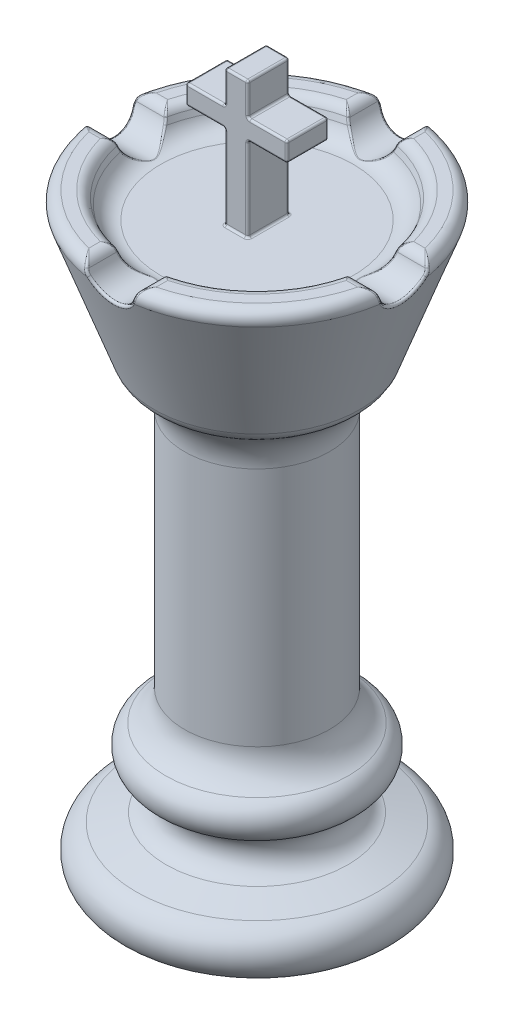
SolidWorks part; units mm, degrees
ref_plane "Front" through (0, 0, 0) normal (0, 0, 1) x (1, 0, 0)
ref_plane "Top" through (0, 0, 0) normal (0, 1, 0) x (1, 0, 0)
ref_plane "Right" through (0, 0, 0) normal (1, 0, 0) x (0, 0, -1)
sketch "Sketch1" plane through (0, 0, 0) normal (0, 0, 1) x (1, 0, 0)
  line L0 (0, 0) -> (0, 72.0534) construction
  line L1 (0, 0) -> (13.97, 0)
  line L2 (14.8003, 5.9807) -> (11.1344, 7.0186)
  line L3 (8.89, 20.2472) -> (8.89, 49.7112)
  line L4 (12.6183, 56.0518) -> (18.796, 73.025)
  line L5 (18.796, 73.025) -> (14.732, 73.025)
  line L6 (0, 69.85) -> (0, 0)
  line L7 (14.732, 73.025) -> (14.1847, 71.5213)
  line L8 (11.7979, 69.85) -> (0, 69.85)
  arc A0 (13.97, 0) -> (14.8003, 5.9807) centre (13.97, 3.048) ccw
  arc A1 (11.1344, 7.0186) -> (10.941, 11.8433) centre (11.8263, 9.4625) cw
  arc A2 (10.941, 11.8433) -> (11.2008, 16.4912) centre (10.0557, 14.224) ccw
  arc A3 (11.2008, 16.4912) -> (8.89, 20.2472) centre (13.0979, 20.2472) cw
  arc A4 (8.89, 49.7112) -> (11.6298, 54.8002) centre (14.986, 49.7112) cw
  arc A5 (11.7979, 69.85) -> (14.1847, 71.5213) centre (11.7979, 72.39) ccw
  arc A6 (12.6183, 56.0518) -> (11.6298, 54.8002) centre (10.2315, 56.9206) cw
  dimension "D2" = 3.048
  dimension "D4" = 2.54
  dimension "D5" = 2.54
  dimension "D7" = 8.89
  dimension "D8" = 4.064
  dimension "D9" = 3.175
  dimension "D11" = 6.096
  dimension "D12" = 14.224
  dimension "D13" = 29.464
  dimension "D14" = 13.97
  dimension "D15" = 11.8263
  dimension "D16" = 4.2079
  dimension "D3" = 3.81
  dimension "D6" = 69.85
  dimension "D10" = 110
  dimension "D17" = 18.796
revolve "Base-Revolve" add sketch "Sketch1" angle 360 about L0
sketch "Sketch2" plane through (0, 73.025, 0) normal (0, 1, 0) x (-1, 0, 0)
  line L0 (0, 0) -> (0, 21.3897) construction
  line L2 (0, 18.796) -> (-3.048, 18.796)
  line L3 (0, 18.796) -> (0, 12.446)
  line L4 (0, 12.446) -> (-3.048, 12.446)
  line L5 (-3.048, 18.796) -> (-3.048, 12.446)
  circle A1 centre (0, 0) radius 18.796 construction
  dimension "D1" = 3.048
  dimension "D2" = 6.35
revolve "Cut-Revolve1" cut sketch "Sketch2" angle 360 about L0
pattern_circular "CirPattern1" count 4 over 360 about axis through (0, 0, 0) along (0, 1, 0) of "Cut-Revolve1"
sketch "Sketch3" plane through (0, 0, 0) normal (0, 0, 1) x (1, 0, 0)
  line L0 (0, 69.85) -> (0, 86.5176)
  line L1 (0, 0) -> (0, 72.0534) construction
  line L2 (0, 86.5176) -> (1.4119, 86.5176)
  line L3 (1.4119, 86.5176) -> (1.4119, 82.5643)
  line L4 (1.4119, 82.5643) -> (6.2124, 82.5643)
  line L5 (6.2124, 82.5643) -> (6.2124, 80.164)
  line L6 (6.2124, 80.164) -> (1.4119, 80.164)
  line L7 (1.4119, 80.164) -> (1.4119, 69.85)
  line L8 (11.7979, 69.85) -> (-11.7979, 69.85) construction
  line L9 (1.4119, 69.85) -> (0, 69.85)
extrude "Boss-Extrude1" add sketch "Sketch3" along normal mid plane 5.08
mirror "Mirror1" about plane through (0, 69.85, 2.54) normal (1, 0, 0) of "Boss-Extrude1"
fillet "Fillet1" radius 1.27 24 edges at (-10.4171, 73.025, 10.4171) (-13.2908, 73.025, 13.2908) (3.048, 73.025, 16.4802) (-0.4065, 70.0042, 17.6919) (-3.048, 73.025, 16.4802) (-2.8751, 72.0129, 14.073) (10.4171, 73.025, 10.4171) (13.2908, 73.025, 13.2908) (16.4802, 73.025, -3.048) (17.6919, 70.0042, 0.4065) (16.4802, 73.025, 3.048) (14.073, 72.0129, 2.8751) (10.4171, 73.025, -10.4171) (13.2908, 73.025, -13.2908) (-3.048, 73.025, -16.4802) (0.4065, 70.0042, -17.6919) (3.048, 73.025, -16.4802) (2.8751, 72.0129, -14.073) (-10.4171, 73.025, -10.4171) (-13.2908, 73.025, -13.2908) (-16.4802, 73.025, 3.048) (-17.6919, 70.0042, -0.4065) (-16.4802, 73.025, -3.048) (-14.073, 72.0129, -2.8751)
fillet "Fillet2" radius 0.254 84 edges at (-1.4119, 69.85, 0) (1.4119, 69.85, 0) (3.4085, 72.8022, -14.5078) (-3.4085, 72.8022, -14.5078) (3.3775, 72.7802, -17.4071) (-3.3775, 72.7802, -17.4071) (-14.5078, 72.8022, -3.4085) (-14.5078, 72.8022, 3.4085) (-17.4071, 72.7802, 3.3775) (-17.4071, 72.7802, -3.3775) (14.5078, 72.8022, 3.4085) (14.5078, 72.8022, -3.4085) (17.4071, 72.7802, 3.3775) (17.4071, 72.7802, -3.3775) (-3.3775, 72.7802, 17.4071) (3.3775, 72.7802, 17.4071) (-3.4085, 72.8022, 14.5078) (3.4085, 72.8022, 14.5078) (-6.2124, 82.5643, 0) (-6.2124, 80.164, 0) (1.4119, 86.5176, 0) (-1.4119, 82.5643, 0) (-1.4119, 86.5176, 0) (6.2124, 80.164, 0) (6.2124, 82.5643, 0) (1.4119, 75.007, -2.54) (3.8122, 80.164, -2.54) (6.2124, 81.3642, -2.54) (3.8122, 82.5643, -2.54) (1.4119, 84.541, -2.54) (0, 86.5176, -2.54) (-1.4119, 84.541, -2.54) (-1.4119, 84.541, 2.54) (-3.8122, 82.5643, -2.54) (-3.8122, 82.5643, 2.54) (-6.2124, 81.3642, -2.54) (-6.2124, 81.3642, 2.54) (-3.8122, 80.164, -2.54) (-3.8122, 80.164, 2.54) (-1.4119, 75.007, -2.54) (-1.4119, 75.007, 2.54) (0, 69.85, -2.54) (0, 86.5176, 2.54) (1.4119, 84.541, 2.54) (3.8122, 82.5643, 2.54) (6.2124, 81.3642, 2.54) (3.8122, 80.164, 2.54) (1.4119, 75.007, 2.54) (0, 69.85, 2.54) (0.4065, 70.0042, -17.6919) (2.7424, 71.6947, -18.0436) (0.1631, 69.9814, -12.6031) (-2.7718, 71.7572, -18.0406) (-18.0436, 71.6947, -2.7424) (-12.6031, 69.9814, -0.1631) (-18.0406, 71.7572, 2.7718) (-17.6919, 70.0042, -0.4065) (17.6919, 70.0042, 0.4065) (18.0436, 71.6947, 2.7424) (12.6031, 69.9814, 0.1631) (18.0406, 71.7572, -2.7718) (-0.1631, 69.9814, 12.6031) (2.7718, 71.7572, 18.0406) (-0.4065, 70.0042, 17.6919) (-2.7424, 71.6947, 18.0436) (-1.4119, 80.164, 0) (1.4119, 80.164, 0) (1.4119, 82.5643, 0)
